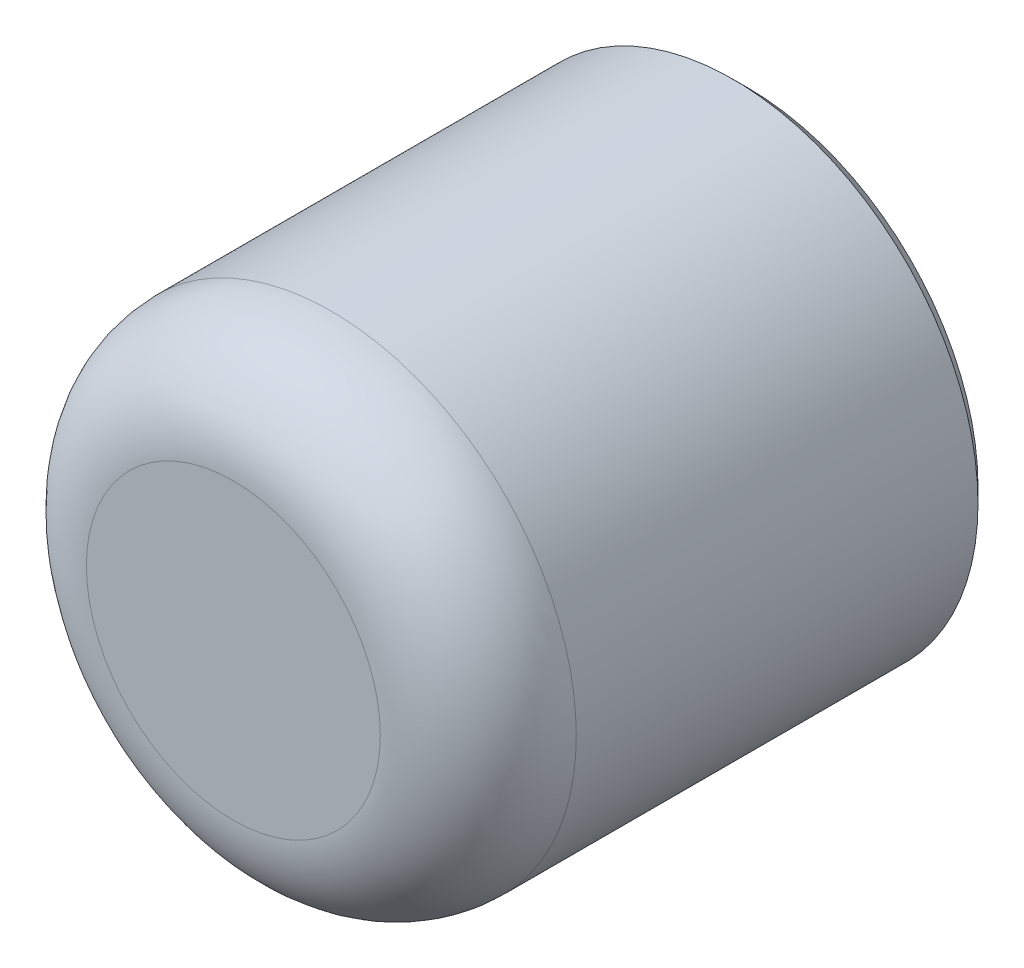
SolidWorks part; units mm, degrees
ref_plane "前视基准面" through (0, 0, 0) normal (0, 0, 1) x (1, 0, 0)
ref_plane "上视基准面" through (0, 0, 0) normal (0, 1, 0) x (1, 0, 0)
ref_plane "右视基准面" through (0, 0, 0) normal (1, 0, 0) x (0, 0, -1)
sketch "草图1" plane through (0, 0, 0) normal (0, 0, 1) x (1, 0, 0)
  circle A0 centre (0, 0) radius 5
  dimension "D1" = 10
extrude "凸台-拉伸1" add sketch "草图1" along normal blind 8.5
hole_wizard "M8 螺纹孔2" positions "草图5" profile "草图3" tap size "M8" standard "GB"
sketch "草图5" plane through (0, 0, 0) normal (0, 0, -1) x (-1, 0, 0)
  point P0 (0, 0)
sketch "草图3" plane through (0, 0, 0) normal (1, 0, 0) x (0, 1, 0)
  line L0 (0, 0) -> (0, 8.5)
  line L1 (0, 8.5) -> (3.4, 8.5)
  line L2 (3.4, 8.5) -> (3.4, 0)
  line L5 (3.4, 0) -> (0, 0)
  line L11 (0, -6.35) -> (0, 107.95) construction
  dimension "通孔螺纹孔钻头直径" = 6.8
  dimension "通孔螺纹孔钻头深度" = 8.5
sketch "草图6" plane through (0, 0, 8.5) normal (0, 0, 1) x (1, 0, 0)
  circle A0 centre (0, 0) radius 5
  circle A1 centre (0, 0) radius 5 construction
extrude "凸台-拉伸2" add sketch "草图6" along normal blind 2
fillet "圆角1" radius 2 1 edges at (5, 0, 10.5)
chamfer "倒角1" distance 0.3 angle 45 2 edges at (5, 0, 0) (-3.4, 0, 0)
sketch "草图7" plane through (0, 0, 8.5) normal (0, 0, -1) x (-1, 0, 0)
  circle A0 centre (0, 0) radius 4
  dimension "D1" = 8
extrude "切除-拉伸2" cut sketch "草图7" along normal blind 1
chamfer "倒角2" distance 0.2 angle 45 1 edges at (-3.4, 0, 7.5)
